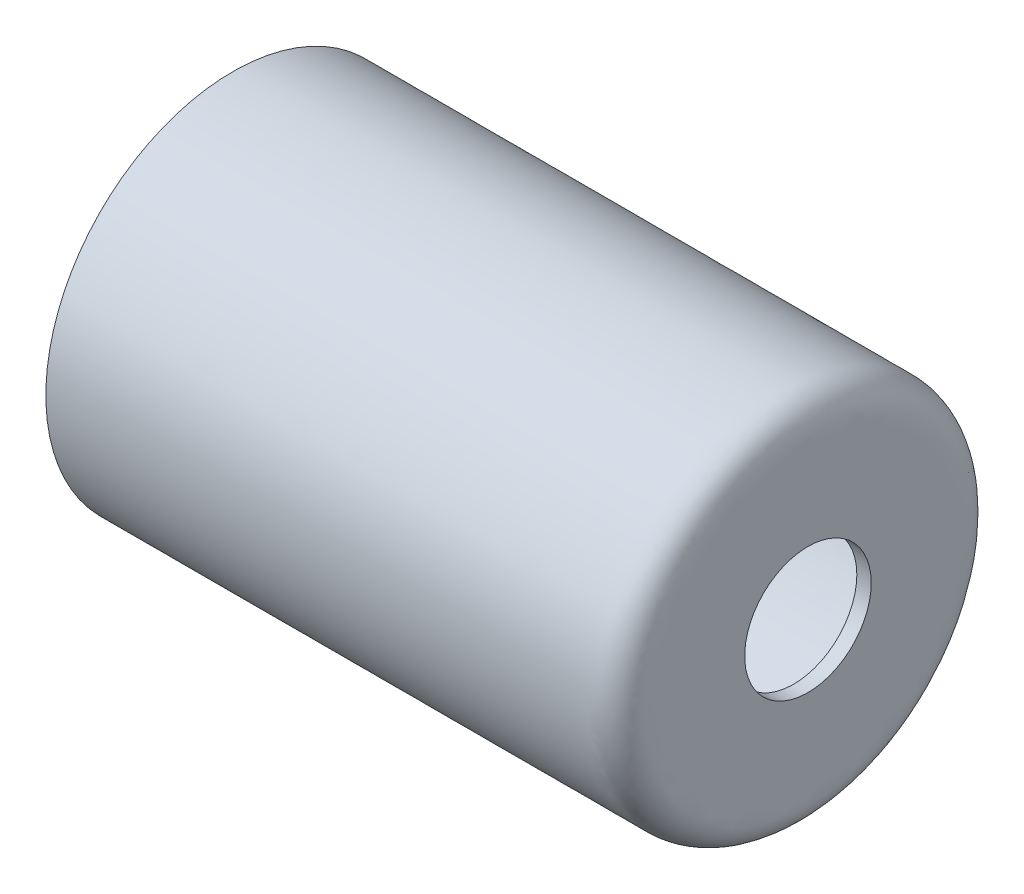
SolidWorks part; units mm, degrees
ref_plane "Vorderseite" through (0, 0, 0) normal (0, 0, 1) x (1, 0, 0)
ref_plane "oben" through (0, 0, 0) normal (0, 1, 0) x (-1, 0, 0)
ref_plane "rechts" through (0, 0, 0) normal (1, 0, 0) x (0, 0, -1)
ref_plane "Ebene1" through (0, 0, 0) normal (0, 0, -1) x (-1, 0, 0)
sketch "Skizze1" plane through (0, 0, 0) normal (0, 0, -1) x (-1, 0, 0)
  line L3 (-10, 2.75) -> (-10, 1.1) construction
  line L4 (-10.5885, 0) -> (0, 0) construction
  line L5 (0, 3.25) -> (-9.5, 3.25) construction
  line L7 (55, 0) -> (-55, 0) construction
  arc A0 (-9.5, 3.25) -> (-10, 2.75) centre (-9.5, 2.75) ccw construction
  dimension "D1" = 0.5
  dimension "D2" = 10
  dimension "D3" = 3.25
  dimension "D4" = 2.2
revolve "Rotation-Dünn1" add sketch "Skizze1" angle 360 about L4
